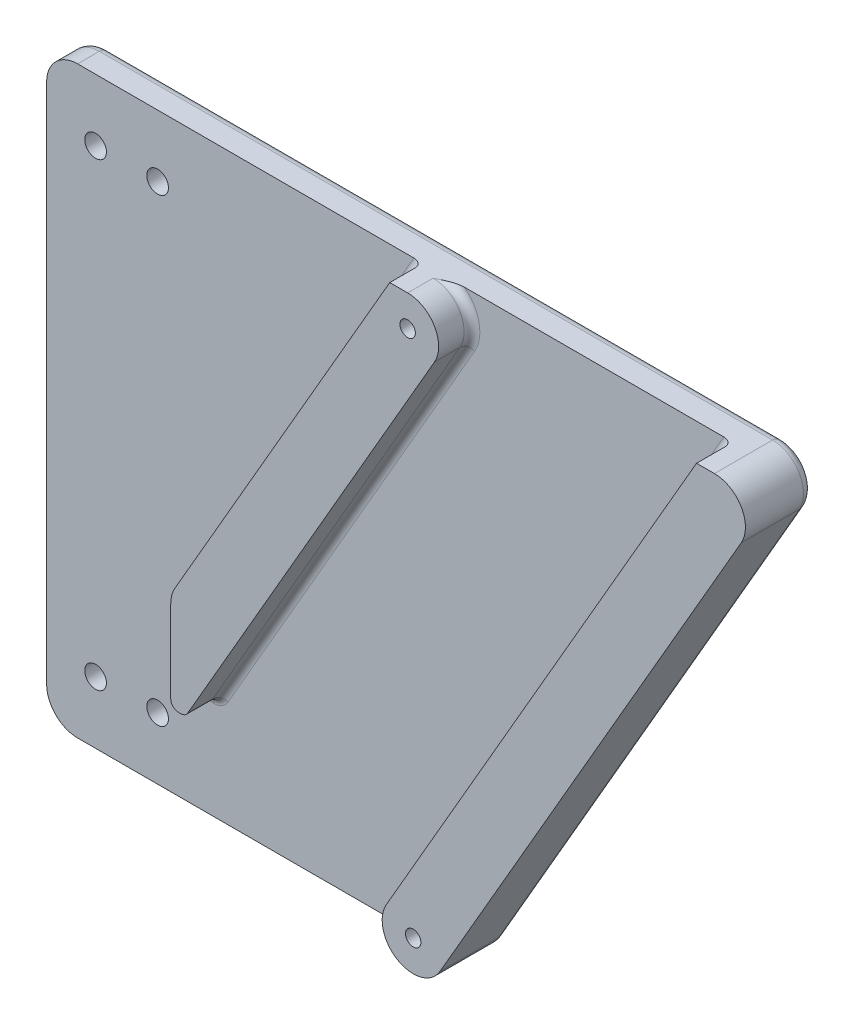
SolidWorks part; units mm, degrees
ref_plane "Front Plane" through (0, 0, 0) normal (0, 0, 1) x (1, 0, 0)
ref_plane "Top Plane" through (0, 0, 0) normal (0, 1, 0) x (1, 0, 0)
ref_plane "Right Plane" through (0, 0, 0) normal (1, 0, 0) x (0, 0, -1)
sketch "Sketch1" plane through (0, 0, 0) normal (0, 0, 1) x (1, 0, 0)
  line L0 (135, -74.2) -> (229.339, 89.2) construction
  line L1 (126.3397, -69.2) -> (220.6788, 94.2)
  line L2 (143.6603, -79.2) -> (237.9993, 84.2)
  line L3 (150, 99.2) -> (150, -99.2) construction
  line L4 (150, -99.2) -> (99.2, -99.2) construction
  line L5 (235, -74.2) -> (329.339, 89.2) construction
  line L6 (226.3397, -69.2) -> (320.6788, 94.2)
  line L7 (243.6603, -79.2) -> (337.9993, 84.2)
  line L8 (150, -99.2) -> (232.1132, -99.2)
  line L9 (329.339, 99.2) -> (150, 99.2)
  line L10 (99.2, 99.2) -> (150, 99.2) construction
  line L11 (99.2, 99.2) -> (150, 99.2)
  line L12 (99.2, 99.2) -> (150, 99.2)
  line L13 (99.2, 99.2) -> (99.2, -99.2)
  line L14 (99.2, -99.2) -> (150, -99.2)
  line L15 (150, 99.2) -> (150, -99.2)
  line L16 (99.2, 99.2) -> (150, -99.2) construction
  line L17 (99.2, -99.2) -> (150, 99.2) construction
  line L18 (150, -99.2) -> (99.2, -99.2)
  line L19 (150, 99.2) -> (150, -99.2) construction
  line L20 (243.6603, -79.2) -> (232.1132, -99.2)
  line L21 (99.2, -94.2) -> (235, -94.2)
  line L22 (99.2, 94.2) -> (337.9993, 94.2)
  line L23 (337.9993, 94.2) -> (343.7728, 94.2)
  line L24 (337.9993, 84.2) -> (343.7728, 94.2)
  arc A0 (126.3397, -69.2) -> (143.6603, -79.2) centre (135, -74.2) ccw
  arc A1 (237.9993, 84.2) -> (220.6788, 94.2) centre (229.339, 89.2) ccw
  circle A3 centre (135, -74.2) radius 3.5 construction
  circle A4 centre (135, -74.2) radius 3.5
  arc A5 (226.3397, -69.2) -> (243.6603, -79.2) centre (235, -74.2) ccw
  arc A6 (337.9993, 84.2) -> (320.6788, 94.2) centre (329.339, 89.2) ccw
  circle A7 centre (115, -74.2) radius 3.5 construction
  circle A8 centre (135, 74.2) radius 3.5 construction
  circle A9 centre (115, 74.2) radius 3.5 construction
  circle A10 centre (135, -74.2) radius 3.5
  circle A11 centre (115, -74.2) radius 3.5
  circle A12 centre (135, 74.2) radius 3.5
  circle A13 centre (115, 74.2) radius 3.5
  point P2 (182.1695, 7.5)
  point P17 (282.1695, 7.5)
  point P30 (124.6, 0)
  dimension "D2" = 86.6025
  dimension "D3" = 5
  dimension "D5" = 10
  dimension "D1" = 30
  dimension "D6" = 5
  dimension "D4" = 2
extrude "Boss-Extrude1" add sketch "Sketch1" along normal blind 10 contours A5 L6 L22 A1 L2 L15 L21 L20 | L2 A1 L22 L1 L15 | L22 L15 L1 | A0 L1 L15 L22 L13 L21 L2 A13 A12 A11 | L1 A0 L2 L15 A4 | A6 L6 A5 L7 | A6 L24 L23
fillet "Fillet1" radius 10 4 edges at (99.2, -94.2, 5) (99.2, 94.2, 5) (235, -94.2, 5) (343.7728, 94.2, 5)
ref_plane "Plane1" through (0, 0, 20.752) normal (0, 0, -1) x (-1, 0, 0)
sketch "Sketch2" plane through (0, 0, 20.752) normal (0, 0, -1) x (-1, 0, 0)
  line L0 (-143.6603, -79.2) -> (-237.9993, 84.2) construction
  line L1 (-150, -68.2192) -> (-243.7728, 94.2)
  line L2 (-126.3397, -69.2) -> (-220.6788, 94.2) construction
  line L3 (-150, -28.2192) -> (-220.6788, 94.2)
  line L4 (-99.2, 94.2) -> (-337.9993, 94.2) construction
  line L5 (-99.2, 94.2) -> (-150, 94.2)
  line L6 (-150, 99.2) -> (-150, -99.2) construction
  line L7 (-150, 99.2) -> (-150, 94.2)
  line L8 (-150, -28.2192) -> (-150, -68.2192)
  line L9 (-220.6788, 94.2) -> (-243.7728, 94.2)
  line L10 (-334.525, -60) -> (135.9125, -60) construction
  line L11 (-334.525, -60) -> (135.9125, -60)
extrude "Boss-Extrude2" add sketch "Sketch2" along normal up to surface (10.752 mm away) contours L3 L9 L1 L8
fillet "Fillet2" radius 10 1 edges at (150, -28.2192, 15.376)
ref_plane "Plane2" through (0, 0, 21.752) normal (0, 0, -1) x (-1, 0, 0)
sketch "Sketch3" plane through (0, 0, 21.752) normal (0, 0, -1) x (-1, 0, 0)
  line L0 (-99.2, 94.2) -> (-337.9993, 94.2) construction
  line L1 (-226.3397, -69.2) -> (-320.6788, 94.2) construction
  line L2 (-99.2, 94.2) -> (-337.9993, 94.2)
  line L3 (-211.906, -94.2) -> (-320.6788, 94.2)
  line L4 (-243.6603, -79.2) -> (-337.9993, 84.2) construction
  line L5 (-243.6603, -79.2) -> (-337.9993, 84.2)
  line L6 (-334.525, -60) -> (135.9125, -60) construction
  line L7 (-334.525, -60) -> (135.9125, -60)
  line L12 (-229.2265, -94.2) -> (-109.2, -94.2)
  line L13 (-99.2, -84.2) -> (-99.2, 84.2)
  line L14 (-109.2, 94.2) -> (-326.4523, 94.2)
  line L15 (-335.1125, 79.2) -> (-237.8868, -89.2)
  line L16 (-229.2265, -94.2) -> (-109.2, -94.2)
  line L17 (-99.2, -84.2) -> (-99.2, 84.2)
  line L18 (-109.2, 94.2) -> (-326.4523, 94.2)
  line L19 (-335.1125, 79.2) -> (-237.8868, -89.2)
  arc A0 (-326.4523, 94.2) -> (-335.1125, 79.2) centre (-326.4523, 84.2) ccw construction
  arc A1 (-326.4523, 94.2) -> (-335.1125, 79.2) centre (-326.4523, 84.2) ccw
  arc A2 (-243.6603, -79.2) -> (-226.3397, -69.2) centre (-235, -74.2) ccw construction
  arc A3 (-243.6603, -79.2) -> (-226.3397, -69.2) centre (-235, -74.2) ccw
  arc A8 (-109.2, -94.2) -> (-99.2, -84.2) centre (-109.2, -84.2) ccw
  arc A9 (-99.2, 84.2) -> (-109.2, 94.2) centre (-109.2, 84.2) ccw
  arc A10 (-326.4523, 94.2) -> (-335.1125, 79.2) centre (-326.4523, 84.2) ccw
  arc A11 (-237.8868, -89.2) -> (-229.2265, -94.2) centre (-229.2265, -84.2) ccw
  arc A12 (-109.2, -94.2) -> (-99.2, -84.2) centre (-109.2, -84.2) ccw
  arc A13 (-99.2, 84.2) -> (-109.2, 94.2) centre (-109.2, 84.2) ccw
  arc A14 (-326.4523, 94.2) -> (-335.1125, 79.2) centre (-326.4523, 84.2) ccw
  arc A15 (-237.8868, -89.2) -> (-229.2265, -94.2) centre (-229.2265, -84.2) ccw
  dimension "D1" = 0
extrude "Boss-Extrude3" add sketch "Sketch3" along normal blind 14.318 contours L5 A3 L3 L2 A1 | L5 A3 L3 L7 | L19 A15 L16 L3 A3
sketch "Sketch4" plane through (0, 0, 21.752) normal (0, 0, 1) x (1, 0, 0)
  circle A0 centre (229.2265, -84.2) radius 2.4892
  circle A1 centre (229.2265, -84.2) radius 10
  arc A2 (229.2265, -94.2) -> (237.8868, -89.2) centre (229.2265, -84.2) ccw construction
  circle A3 centre (226.4523, 84.2) radius 10 construction
  circle A4 centre (226.4523, 84.2) radius 10
  circle A5 centre (226.4523, 84.2) radius 2.4892
  dimension "D1" = 4.9784
  dimension "D2" = 20
  dimension "D3" = 4.9784
extrude "Cut-Extrude1" cut sketch "Sketch4" against normal blind 90.5 contours A5 | A0
fillet "Fillet3" radius 3 8 edges at (102.1289, -91.2711, 0) (99.2, 0, 0) (102.1289, 91.2711, 0) (217.8261, 94.2, 0) (335.1125, 89.2, 0) (286.4996, -5, 0) (234.2265, -92.8603, 0) (169.2132, -94.2, 0)
fillet "Fillet4" radius 10 2 edges at (243.7728, 94.2, 15.376) (211.906, -94.2, 15.876)
fillet "Fillet5" radius 2.54 2 edges at (154.7454, -60, 15.376) (150, -60, 15.376)
fillet "Fillet6" radius 2.54 10 edges at (220.5662, -89.2, 10) (235.1125, 89.2, 10) (195.2956, 10.235, 10) (154.5489, -59.6597, 10) (152.9095, -60, 10) (150.7439, -59.2561, 10) (150, -44.1794, 10) (150.3407, -28.3105, 10) (270.6225, 7.5, 10) (186.0093, 34.1506, 10)
